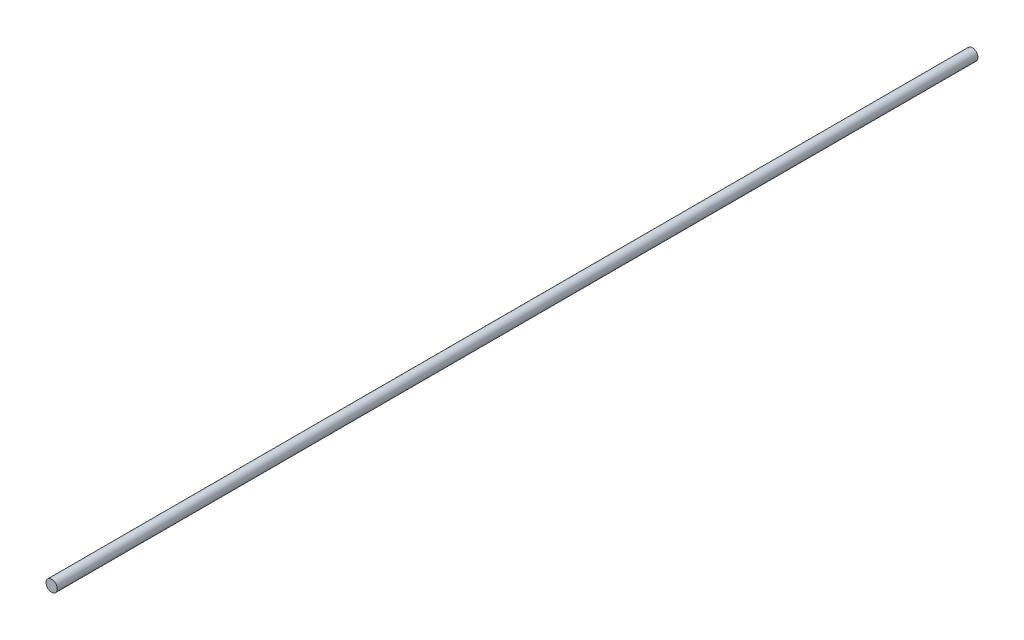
SolidWorks part; units mm, degrees
ref_plane "Front Plane" through (0, 0, 0) normal (0, 0, 1) x (1, 0, 0)
ref_plane "Top Plane" through (0, 0, 0) normal (0, 1, 0) x (1, 0, 0)
ref_plane "Right Plane" through (0, 0, 0) normal (1, 0, 0) x (0, 0, -1)
sketch "Sketch1" plane through (0, 0, 0) normal (0, 0, 1) x (1, 0, 0)
  circle A0 centre (0, 0) radius 30
  dimension "D1" = 60
extrude "Boss-Extrude1" add sketch "Sketch1" against normal blind 4900
